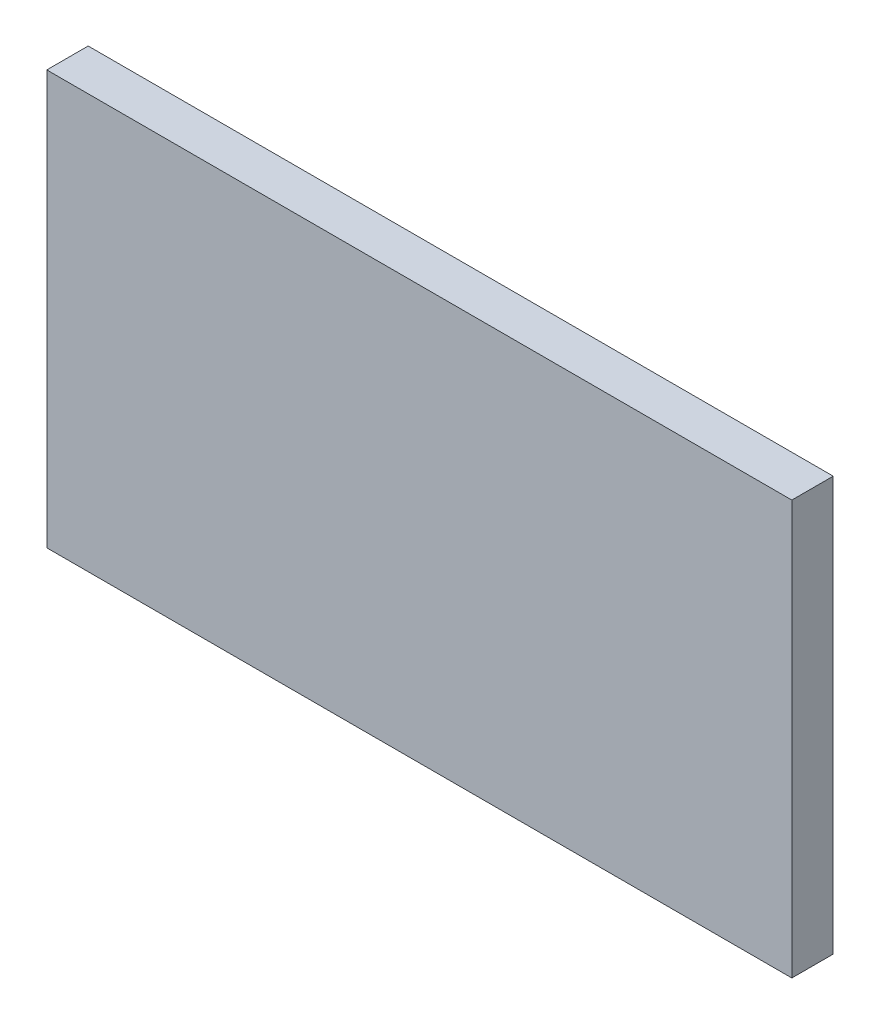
SolidWorks part; units mm, degrees
ref_plane "Front Plane" through (0, 0, 0) normal (0, 0, 1) x (1, 0, 0)
ref_plane "Top Plane" through (0, 0, 0) normal (0, 1, 0) x (1, 0, 0)
ref_plane "Right Plane" through (0, 0, 0) normal (1, 0, 0) x (0, 0, -1)
sketch "Sketch2" plane through (0, 0, 0) normal (0, 0, 1) x (1, 0, 0)
  line L1 (0, 0) -> (11.43, 0)
  line L2 (0, 0) -> (0, 6.35)
  line L3 (0, 6.35) -> (11.43, 6.35)
  line L4 (11.43, 0) -> (11.43, 6.35)
extrude "Extrude2" add sketch "Sketch2" along normal blind 0.635
